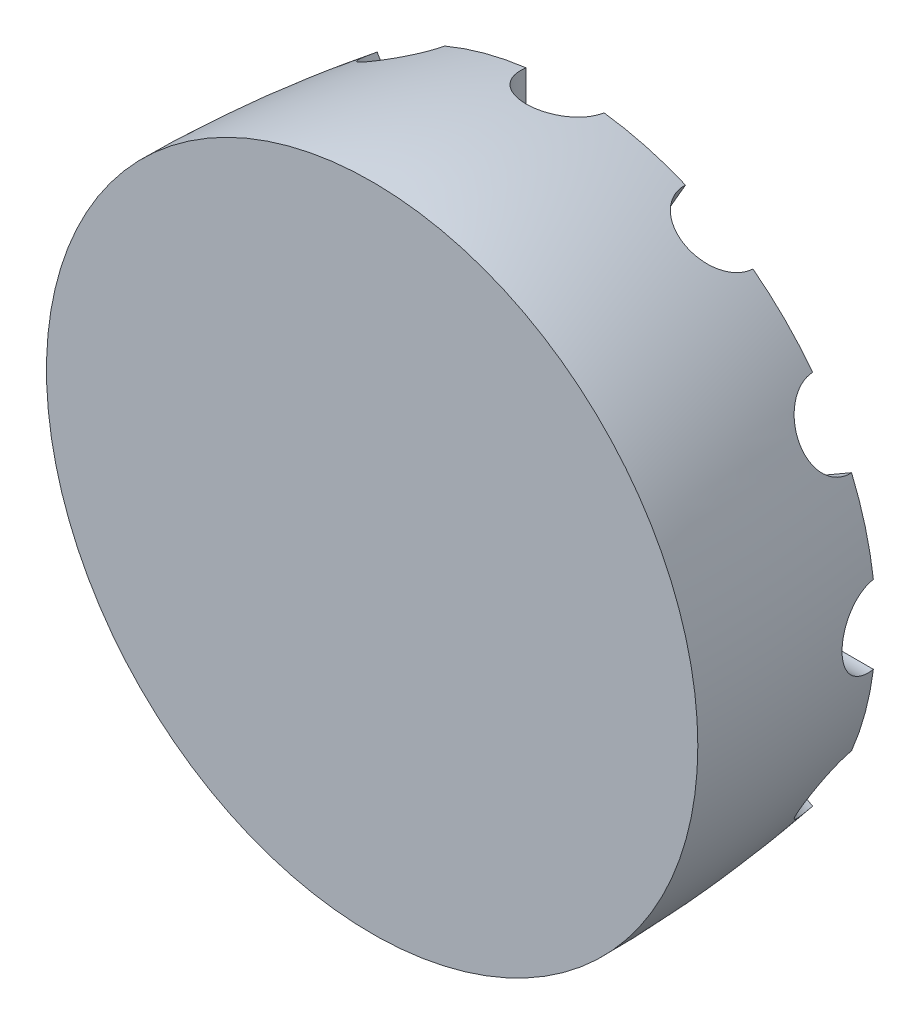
SolidWorks part; units mm, degrees
ref_plane "Front Plane" through (0, 0, 0) normal (0, 0, 1) x (1, 0, 0)
ref_plane "Top Plane" through (0, 0, 0) normal (0, 1, 0) x (1, 0, 0)
ref_plane "Right Plane" through (0, 0, 0) normal (1, 0, 0) x (0, 0, -1)
body saved out of another part "ECOSTEM-3D BLADE-HUB BASE PART"
